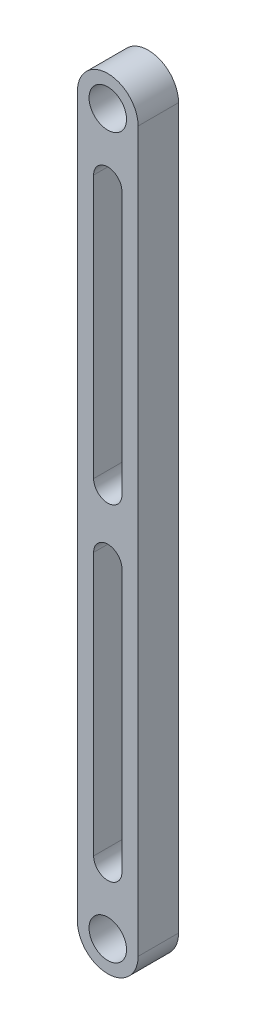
SolidWorks part; units mm, degrees
ref_plane "Front Plane" through (0, 0, 0) normal (0, 0, 1) x (1, 0, 0)
ref_plane "Top Plane" through (0, 0, 0) normal (0, 1, 0) x (1, 0, 0)
ref_plane "Right Plane" through (0, 0, 0) normal (1, 0, 0) x (0, 0, -1)
sketch "Sketch1" plane through (0, 0, 0) normal (0, 0, 1) x (1, 0, 0)
  line L0 (0, -88.9) -> (0, 88.9) construction
  line L1 (-7.5, -88.9) -> (-7.5, 88.9)
  line L2 (7.5, -88.9) -> (7.5, 88.9)
  line L3 (0, -72.9) -> (0, -7.9) construction
  line L4 (-3.5, -72.9) -> (-3.5, -7.9)
  line L5 (3.5, -72.9) -> (3.5, -7.9)
  line L6 (0, 72.9) -> (0, 7.9) construction
  line L7 (3.5, 72.9) -> (3.5, 7.9)
  line L8 (-3.5, 72.9) -> (-3.5, 7.9)
  line L9 (-3.5, 40.4) -> (3.5, 40.4) construction
  line L10 (-3.5, -40.4) -> (3.5, -40.4) construction
  line L11 (-4.635, -88.9) -> (-3.5, -72.9) construction
  line L12 (-4.635, 88.9) -> (-3.5, 72.9) construction
  arc A0 (-7.5, -88.9) -> (7.5, -88.9) centre (0, -88.9) ccw
  arc A1 (7.5, 88.9) -> (-7.5, 88.9) centre (0, 88.9) ccw
  circle A2 centre (0, -88.9) radius 4.635
  circle A3 centre (0, 88.9) radius 4.635
  arc A4 (-3.5, -72.9) -> (3.5, -72.9) centre (0, -72.9) ccw
  arc A5 (3.5, -7.9) -> (-3.5, -7.9) centre (0, -7.9) ccw
  arc A6 (3.5, 72.9) -> (-3.5, 72.9) centre (0, 72.9) ccw
  arc A7 (-3.5, 7.9) -> (3.5, 7.9) centre (0, 7.9) ccw
  point P2 (0, 0)
  point P14 (0, -40.4)
  point P19 (0, 40.4)
  dimension "D3" = 9.27
  dimension "D1" = 177.8
  dimension "D2" = 15
  dimension "D4" = 7
  dimension "60" = 65
  dimension "D6" = 16
extrude "Boss-Extrude1" add sketch "Sketch1" along normal blind 10
